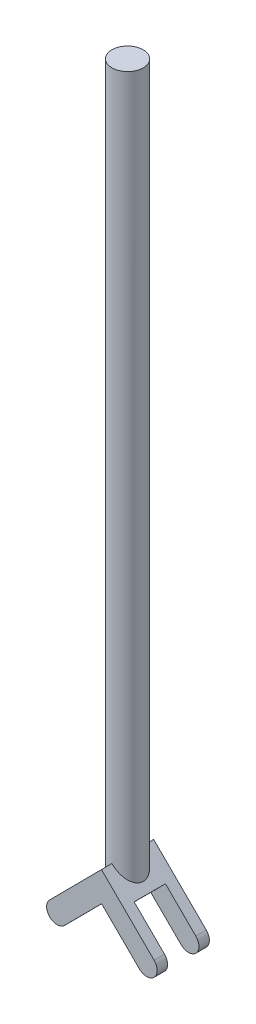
SolidWorks part; units mm, degrees
ref_plane "Front Plane" through (0, 0, 0) normal (0, 0, 1) x (1, 0, 0)
ref_plane "Top Plane" through (0, 0, 0) normal (0, 1, 0) x (1, 0, 0)
ref_plane "Right Plane" through (0, 0, 0) normal (1, 0, 0) x (0, 0, -1)
sketch "Sketch2" plane through (0, 0, 0) normal (0, 0, 1) x (1, 0, 0)
  line L0 (0, 0) -> (-31.5067, -31.7491)
  line L1 (-31.5067, -31.7491) -> (31.9933, -31.7491) construction
  line L2 (31.9933, -31.7491) -> (0, 0)
  line L3 (23.0475, -40.7637) -> (0.0688, -17.9604)
  line L4 (0.0688, -17.9604) -> (-22.4921, -40.6949)
  arc A0 (-31.5067, -31.7491) -> (-22.4921, -40.6949) centre (-26.9994, -36.222) ccw
  arc A1 (23.0475, -40.7637) -> (31.9933, -31.7491) centre (27.5204, -36.2564) ccw
  dimension "D1" = 63.5
  dimension "D2" = 44.7289
  dimension "D3" = 12.7
extrude "Boss-Extrude1" add sketch "Sketch2" along normal blind 31.75
sketch "Sketch3" plane through (0, 0, 0) normal (-0.7098, 0.7044, 0) x (0, 0, 1)
  line L0 (0, -51.0789) -> (31.75, -51.0789) construction
  line L1 (6.35, -19.05) -> (25.4, -19.05)
  line L2 (6.35, -19.05) -> (6.35, -51.0789)
  line L3 (6.35, -51.0789) -> (25.4, -51.0789)
  line L4 (25.4, -19.05) -> (25.4, -51.0789)
  line L5 (6.35, -19.05) -> (25.4, -51.0789) construction
  line L6 (6.35, -51.0789) -> (25.4, -19.05) construction
  line L7 (0, 0) -> (0, -44.7289) construction
  line L8 (31.75, 0) -> (31.75, -44.7289) construction
  line L9 (31.75, 0) -> (0, 0) construction
  point P4 (15.875, -35.0645)
  dimension "D1" = 6.35
  dimension "D2" = 6.35
  dimension "D3" = 19.05
extrude "Cut-Extrude1" cut sketch "Sketch3" against normal through all
sketch "Sketch4" plane through (0, 0, 0) normal (0.7044, 0.7098, 0) x (0.7098, -0.7044, 0)
  line L0 (51.423, -31.75) -> (51.423, 0) construction
  line L1 (51.423, -6.35) -> (19.05, -6.35)
  line L2 (51.423, -6.35) -> (51.423, -25.4)
  line L3 (51.423, -25.4) -> (19.05, -25.4)
  line L4 (19.05, -6.35) -> (19.05, -25.4)
  line L5 (51.423, -6.35) -> (19.05, -25.4) construction
  line L6 (51.423, -25.4) -> (19.05, -6.35) construction
  line L7 (0, -31.75) -> (0, 0) construction
  line L8 (45.073, 0) -> (0, 0) construction
  line L9 (45.073, -31.75) -> (0, -31.75) construction
  point P4 (35.2365, -15.875)
  dimension "D1" = 19.05
  dimension "D2" = 6.35
  dimension "D3" = 6.35
extrude "Cut-Extrude2" cut sketch "Sketch4" against normal through all
ref_plane "Plane4" through (0, 0, 15.875) normal (0, 0, -1) x (-1, 0, 0)
ref_plane "Plane5" through (0, -12.7, 0) normal (0, 1, 0) x (1, 0, 0)
sketch "Sketch5" plane through (0, -12.7, 0) normal (0, 1, 0) x (1, 0, 0)
  line L0 (0, -31.75) -> (0, 0) construction
  circle A0 centre (0, -15.875) radius 9.525
  dimension "D1" = 19.05
extrude "Boss-Extrude2" add sketch "Sketch5" along normal blind 431.8
